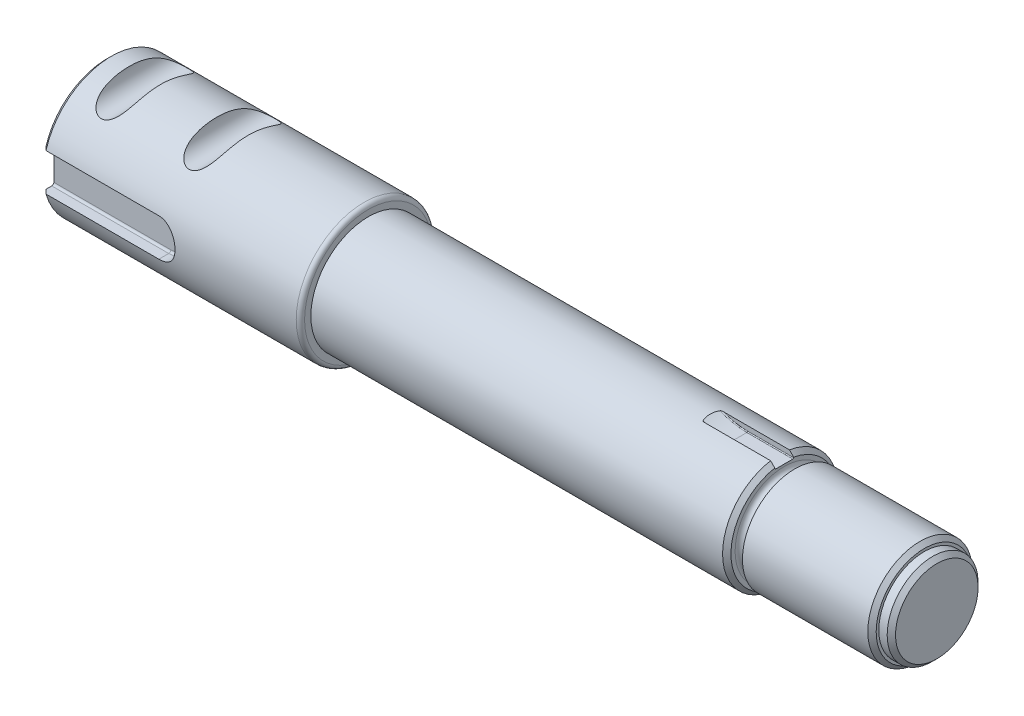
SolidWorks part; units mm, degrees
ref_plane "Plan de face" through (0, 0, 0) normal (0, 0, 1) x (1, 0, 0)
ref_plane "Plan de dessus" through (0, 0, 0) normal (0, 1, 0) x (1, 0, 0)
ref_plane "Plan de droite" through (0, 0, 0) normal (1, 0, 0) x (0, 0, -1)
sketch "Esquisse4" plane through (0, 0, 0) normal (0, 0, 1) x (1, 0, 0)
  line L0 (0, 32.5) -> (0, 0)
  line L1 (125, 27.5) -> (125, 32.5)
  line L2 (0, 0) -> (397, 0)
  line L3 (125, 32.5) -> (0, 32.5)
  line L4 (0, 0) -> (408.185, 0) construction
  line L5 (322, 27.5) -> (324, 25.5)
  line L6 (125, 27.5) -> (322, 27.5)
  line L9 (324, 25.5) -> (324, 23.5)
  line L10 (329, 23.5) -> (329, 25)
  line L11 (329, 25) -> (391, 25)
  line L12 (391, 25) -> (391, 21.75)
  line L13 (391, 21.75) -> (397, 21.75)
  line L14 (397, 21.75) -> (397, 0)
  arc A0 (324, 23.5) -> (329, 23.5) centre (326.5, 23.5) ccw
  point P12 (277, 0)
  dimension "D5" = 2.5
  dimension "D7" = 32.5
  dimension "D2" = 27.5
  dimension "D3" = 125
  dimension "D4" = 25
  dimension "D6" = 5
  dimension "D8" = 2
  dimension "D9" = 45
  dimension "D10" = 397
  dimension "D11" = 23.5
  dimension "D12" = 6
  dimension "D13" = 21.75
  dimension "D15" = 73
revolve "Révolution1" add sketch "Esquisse4" angle 360 about L4
chamfer "Chanfrein1" distance 2 angle 45 2 edges at (397, 0, 21.75) (391, 0, 25)
fillet "Congé1" radius 2 1 edges at (125, 0, 32.5)
chamfer "Chanfrein2" distance 2 angle 45 1 edges at (0, 0, 32.5)
sketch "Esquisse5" plane through (0, 0, 0) normal (0, 0, 1) x (1, 0, 0)
  line L0 (123, 32.5) -> (2, 32.5) construction
  line L1 (0, 30.5) -> (0, -30.5) construction
  line L2 (2, -32.5) -> (123, -32.5) construction
  circle A0 centre (18, 32.5) radius 7.5
  circle A1 centre (60, 32.5) radius 7.5
  circle A2 centre (18, -32.5) radius 7.5
  circle A3 centre (60, -32.5) radius 7.5
  dimension "D1" = 15
  dimension "D2" = 15
  dimension "D5" = 15
  dimension "D6" = 15
  dimension "D7" = 42
  dimension "D3" = 18
  dimension "D4" = 60
  dimension "D8" = 60
extrude "Extrusion3" cut sketch "Esquisse5" against normal mid plane 152
ref_plane "Plan1" through (0, 0, 32.5) normal (0, 0, 1) x (1, 0, 0)
sketch "Esquisse6" plane through (0, 0, 32.5) normal (0, 0, 1) x (1, 0, 0)
  line L0 (0, 30.5) -> (0, -30.5) construction
  line L1 (0, 9) -> (56, 9)
  line L2 (0, 9) -> (0, -9)
  line L3 (0, -9) -> (56, -9)
  line L5 (0, 0) -> (97.6711, 0) construction
  arc A0 (56, 9) -> (56, -9) centre (56, 0) cw
  dimension "D2" = 9
  dimension "D1" = 18
  dimension "D3" = 56
extrude "Extrusion4" cut sketch "Esquisse6" against normal blind 7
sketch "Esquisse7" plane through (0, 0, 0) normal (0, 0, 1) x (1, 0, 0)
  line L0 (324, 24.5) -> (302, 24.5)
  line L1 (324, -25.5) -> (324, 25.5) construction
  line L2 (397, -19.75) -> (397, 19.75) construction
  line L3 (322, 27.5) -> (125, 27.5) construction
  line L4 (271.7823, 47.1039) -> (324, 47.1039)
  line L5 (324, 47.1039) -> (324, 24.5)
  arc A0 (302, 24.5) -> (271.7823, 47.1039) centre (302, 56) cw
  dimension "D2" = 31.5
  dimension "D1" = 95
  dimension "D3" = 3
extrude "Extrusion5" cut sketch "Esquisse7" against normal mid plane 9
fillet "Congé2" radius 1 3 edges at (28, -9, 25.5) (65, 0, 25.5) (28, 9, 25.5)
fillet "Congé3" radius 0.4 4 edges at (295.5648, 25.1643, 4.5) (295.5648, 25.1643, -4.5) (313, 24.5, 4.5) (313, 24.5, -4.5)
